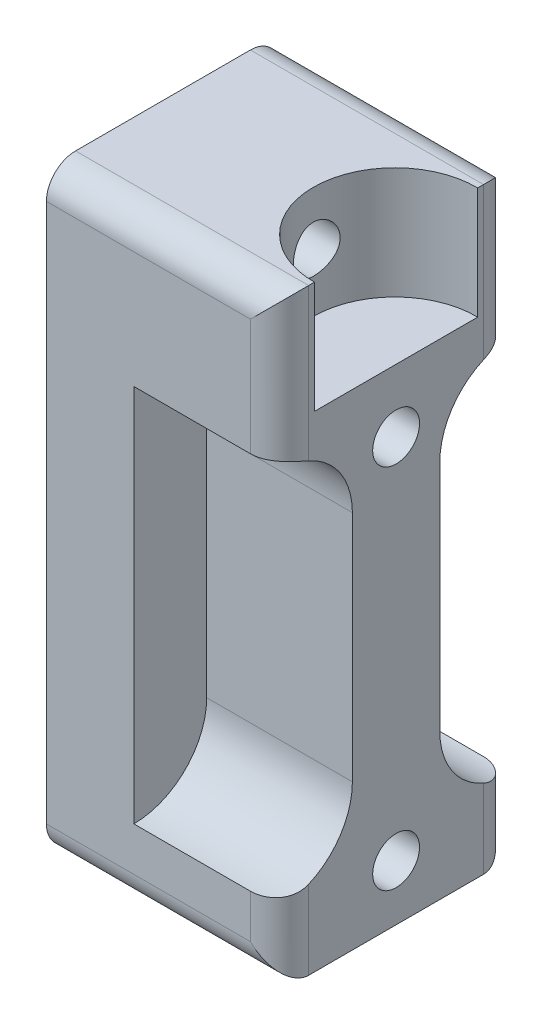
SolidWorks part; units mm, degrees
ref_plane "Front" through (0, 0, 0) normal (0, 0, 1) x (1, 0, 0)
ref_plane "Top" through (0, 0, 0) normal (0, 1, 0) x (1, 0, 0)
ref_plane "Right" through (0, 0, 0) normal (1, 0, 0) x (0, 0, -1)
sketch "Sketch1" plane through (0, 0, 0) normal (0, 1, 0) x (1, 0, 0)
  line L0 (0.127, 0) -> (0, 0) construction
  line L1 (-25.273, 12.7) -> (0.127, 12.7)
  line L2 (-25.273, 12.7) -> (-25.273, -12.7)
  line L3 (-25.273, -12.7) -> (0.127, -12.7)
  line L4 (0.127, 12.7) -> (0.127, -12.7)
  circle A0 centre (0, 0) radius 8.89 construction
  dimension "D1" = 17.78
  dimension "D2" = 25.4
  dimension "D3" = 25.4
  dimension "D4" = 25.273
extrude "Boss-Extrude1" add sketch "Sketch1" against normal blind 65.0875
sketch "Sketch2" plane through (0, 0, 0) normal (0, 1, 0) x (1, 0, 0)
  circle A0 centre (0, 0) radius 8.89 construction
  circle A1 centre (0, 0) radius 8.89
extrude "Cut-Extrude1" cut sketch "Sketch2" against normal blind 12.192
hole_wizard "1/4-20 Tapped Hole1" positions "Sketch4" profile "Sketch3" tap size "1/4-20" standard "Ansi Inch"
sketch "Sketch4" plane through (-25.273, 0, 0) normal (-1, 0, 0) x (0, 0, 1)
  line L1 (-12.7, 0) -> (12.7, 0) construction
  point P0 (0, -5.842)
  point P4 (0, -59.0233)
  point P5 (0, -19.05)
  point P11 (0, 0)
  dimension "D1" = 5.842
  dimension "D2" = 53.1813
  dimension "D3" = 19.05
sketch "Sketch3" plane through (-25.273, -5.842, 0) normal (0, 1, 0) x (0, 0, 1)
  line L0 (0, 0) -> (0, 25.4)
  line L1 (0, 25.4) -> (2.5527, 25.4)
  line L2 (2.5527, 25.4) -> (2.5527, 0)
  line L5 (2.5527, 0) -> (0, 0)
  line L11 (0, -6.35) -> (0, 107.95) construction
  dimension "Thru Tap Drill Dia." = 5.1054
  dimension "Thru Tap Drill Depth" = 25.4
sketch "Sketch5" plane through (0.127, 0, 0) normal (1, 0, 0) x (0, 0, -1)
  line L0 (12.7, -49.2125) -> (12.7, -23.8125) construction
  line L1 (12.7, -65.0875) -> (12.7, 0) construction
  line L2 (4.7625, -49.2125) -> (4.7625, -23.8125)
  line L3 (20.6375, -49.2125) -> (20.6375, -23.8125)
  line L4 (0, 0) -> (0, 13.1295) construction
  line L5 (-12.7, -49.2125) -> (-12.7, -23.8125) construction
  line L6 (-4.7625, -49.2125) -> (-4.7625, -23.8125)
  line L7 (-20.6375, -49.2125) -> (-20.6375, -23.8125)
  arc A0 (4.7625, -49.2125) -> (20.6375, -49.2125) centre (12.7, -49.2125) ccw
  arc A1 (20.6375, -23.8125) -> (4.7625, -23.8125) centre (12.7, -23.8125) ccw
  arc A2 (-4.7625, -49.2125) -> (-20.6375, -49.2125) centre (-12.7, -49.2125) cw
  arc A3 (-20.6375, -23.8125) -> (-4.7625, -23.8125) centre (-12.7, -23.8125) cw
  point P4 (12.7, -36.5125)
  point P14 (-12.7, -36.5125)
  dimension "D3" = 7.9375
  dimension "D1" = 36.5125
  dimension "D2" = 25.4
extrude "Cut-Extrude2" cut sketch "Sketch5" against normal blind 15.875
fillet "Fillet1" radius 3.175 8 edges at (-12.573, 0, 12.7) (-12.573, 0, -12.7) (-12.573, -65.0875, 12.7) (-12.573, -65.0875, -12.7) (0.127, -61.1188, 12.7) (0.127, -61.1188, -12.7) (0.127, -7.9375, -12.7) (0.127, -7.9375, 12.7)
equation "\"Buoyancy\"=\"SW-Volume\"*(\"SW-Density\"-.037062)"
